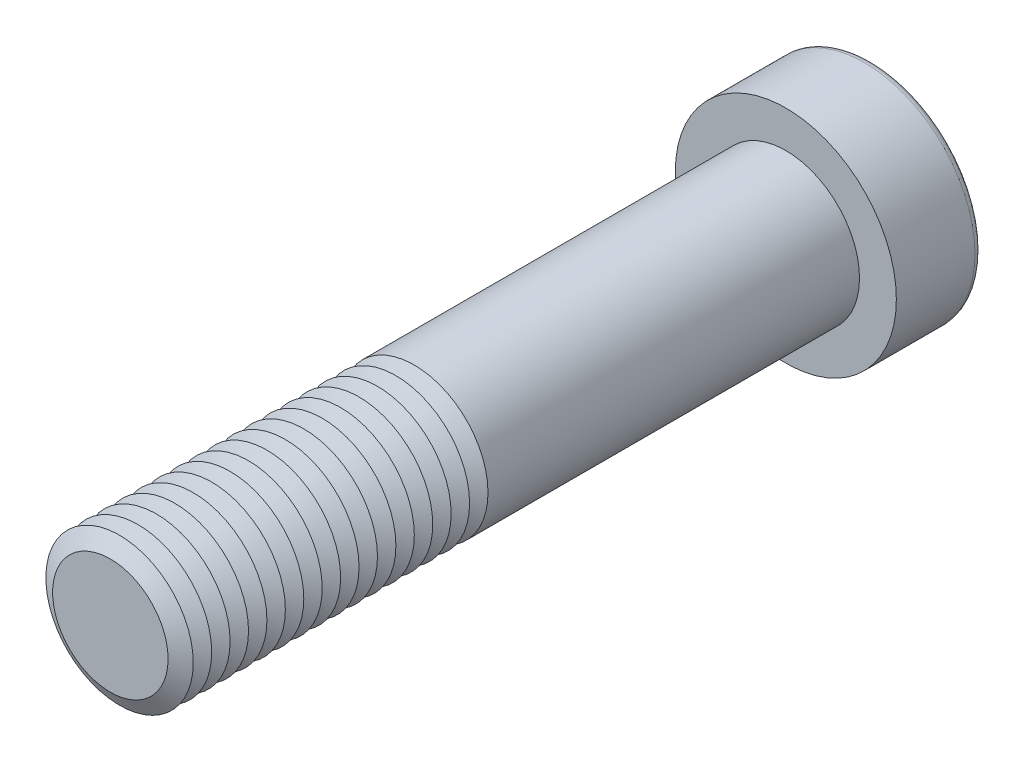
SolidWorks part; units mm, degrees
ref_plane "Front Plane" through (0, 0, 0) normal (0, 0, 1) x (1, 0, 0)
ref_plane "Top Plane" through (0, 0, 0) normal (0, 1, 0) x (1, 0, 0)
ref_plane "Right Plane" through (0, 0, 0) normal (1, 0, 0) x (0, 0, -1)
sketch "Sketch1" plane through (0, 0, 0) normal (0, 0, 1) x (1, 0, 0)
  circle A0 centre (0, 0) radius 12
  dimension "D1" = 24
extrude "Boss-Extrude1" add sketch "Sketch1" along normal blind 110
sketch "Sketch2" plane through (0, 0, 0) normal (0, 0, -1) x (-1, 0, 0)
  circle A0 centre (0, 0) radius 18
  dimension "D1" = 36
extrude "Boss-Extrude2" add sketch "Sketch2" along normal blind 14
sketch "Sketch3" plane through (0, 0, -14) normal (0, 0, -1) x (-1, 0, 0)
  line L1 (-5.4848, 9.5) -> (-10.9697, 0)
  line L2 (-10.9697, 0) -> (-5.4848, -9.5)
  line L3 (-5.4848, -9.5) -> (5.4848, -9.5)
  line L4 (5.4848, -9.5) -> (10.9697, 0)
  line L5 (10.9697, 0) -> (5.4848, 9.5)
  line L6 (5.4848, 9.5) -> (-5.4848, 9.5)
  circle A0 centre (0, 0) radius 9.5 construction
  dimension "D1" = 19
extrude "Cut-Extrude1" cut sketch "Sketch3" against normal blind 14.25
fillet "Fillet1" radius 1.2 1 edges at (-18, 0, -14)
sketch "Sketch4" plane through (0, 0, 0.25) normal (0, 0, -1) x (-1, 0, 0)
  line L0 (5.4848, -9.5) -> (10.9697, 0) construction
  circle A0 centre (0, 0) radius 9.5
extrude "Cut-Extrude2" cut sketch "Sketch4" against normal through all draft 60
sketch "Sketch5" plane through (0, 0, -14) normal (0, 0, -1) x (-1, 0, 0)
  circle A0 centre (0, 0) radius 10.9697
extrude "Cut-Extrude3" cut sketch "Sketch5" against normal through all draft 75
sketch "Sketch7" plane through (0, 0, 0) normal (1, 0, 0) x (0, 0, -1)
  line L25 (-110, 9.4019) -> (-108.5, 12)
  line L26 (-110, 12) -> (-110, -12) construction
  line L27 (-108.5, 12) -> (-111.5, 12)
  line L28 (-111.5, 12) -> (-110, 9.4019)
  line L29 (0, 12) -> (-110, 12) construction
  dimension "D1" = 3
revolve "Cut-Revolve1" cut sketch "Sketch7" angle 360 about axis through (0, 0, 110) along (0, 0, -1)
pattern_linear "LPattern1" count 17 spacing 3 along (0, 0, -1) of "Cut-Revolve1"
